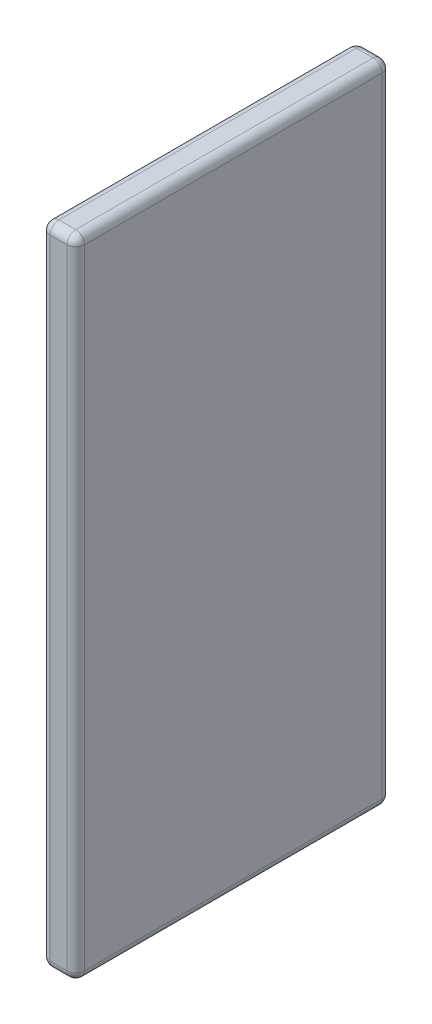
SolidWorks part; units mm, degrees
other "Objet de détail1"
ref_plane "Plan de face" through (0, 0, 0) normal (0, 0, 1) x (1, 0, 0)
ref_plane "Plan de dessus" through (0, 0, 0) normal (0, 1, 0) x (1, 0, 0)
ref_plane "Plan de droite" through (0, 0, 0) normal (1, 0, 0) x (0, 0, -1)
sketch "Esquisse1" plane through (0, 0, 0) normal (1, 0, 0) x (0, 0, -1)
  line L1 (0, 0) -> (71.5, 0)
  line L2 (0, 0) -> (0, 146.7)
  line L3 (0, 146.7) -> (71.5, 146.7)
  line L4 (71.5, 0) -> (71.5, 146.7)
  dimension "D1" = 146.7
  dimension "D2" = 71.5
extrude "Boss.-Extru.1" add sketch "Esquisse1" along normal blind 7.8
fillet "Congé1" radius 2 4 edges at (3.9, 146.7, -71.5) (7.8, 146.7, -35.75) (3.9, 146.7, 0) (0, 146.7, -35.75)
fillet "Congé2" radius 2 5 edges at (7.2142, 146.1142, -70.9142) (0.5858, 146.1142, -70.9142) (3.9, 0, -71.5) (7.8, 72.35, -71.5) (0, 72.35, -71.5)
fillet "Congé3" radius 2 5 edges at (7.2142, 0.5858, -70.9142) (0.5858, 0.5858, -70.9142) (3.9, 0, 0) (7.8, 0, -34.75) (0, 0, -34.75)
fillet "Congé4" radius 2 6 edges at (7.2142, 146.1142, -0.5858) (7.2142, 0.5858, -0.5858) (0.5858, 146.1142, -0.5858) (0.5858, 0.5858, -0.5858) (7.8, 73.35, 0) (0, 73.35, 0)
